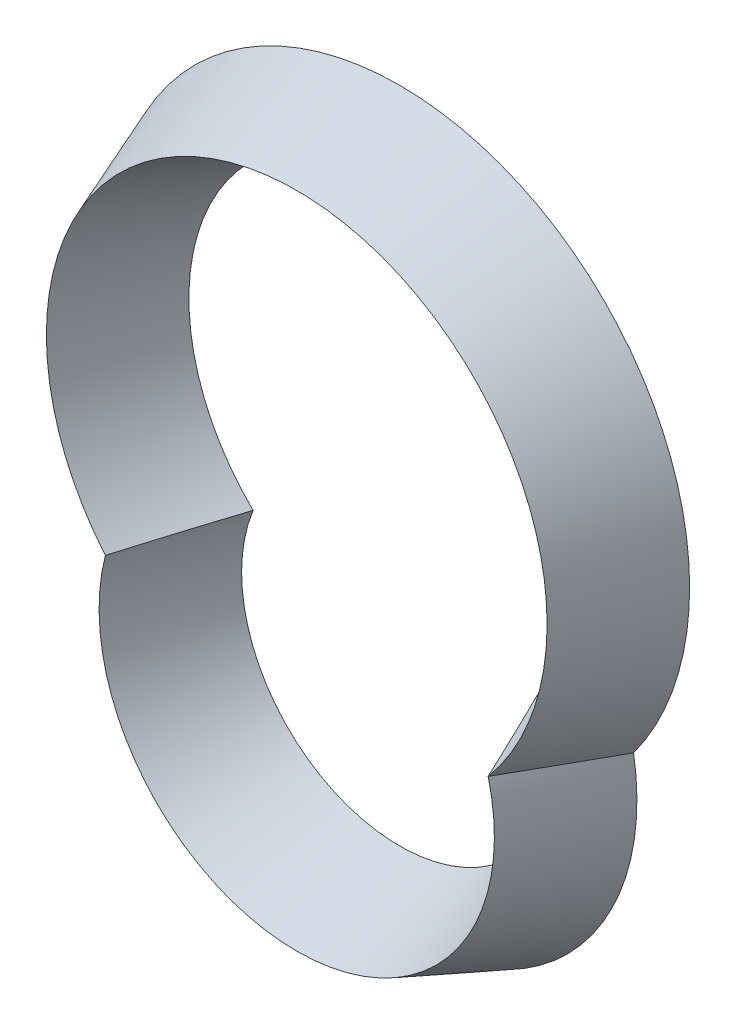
SolidWorks part; units mm, degrees
ref_plane "Front" through (0, 0, 0) normal (0, 0, 1) x (1, 0, 0)
ref_plane "Top" through (0, 0, 0) normal (0, 1, 0) x (1, 0, 0)
ref_plane "Right" through (0, 0, 0) normal (1, 0, 0) x (0, 0, -1)
sketch "Sketch1" plane through (0, 0, 0) normal (0, 0, 1) x (1, 0, 0)
  arc A0 (0, 0) -> (55.6215, 0) centre (27.8107, -11.25) ccw
  arc A1 (55.6215, 0) -> (0, 0) centre (27.8107, 28.75) ccw
  dimension "D1" = 30
  dimension "D2" = 40
  dimension "D3" = 40
extrude "Extrude-Thin1" add sketch "Sketch1" along normal blind 20 draft 21 thin
